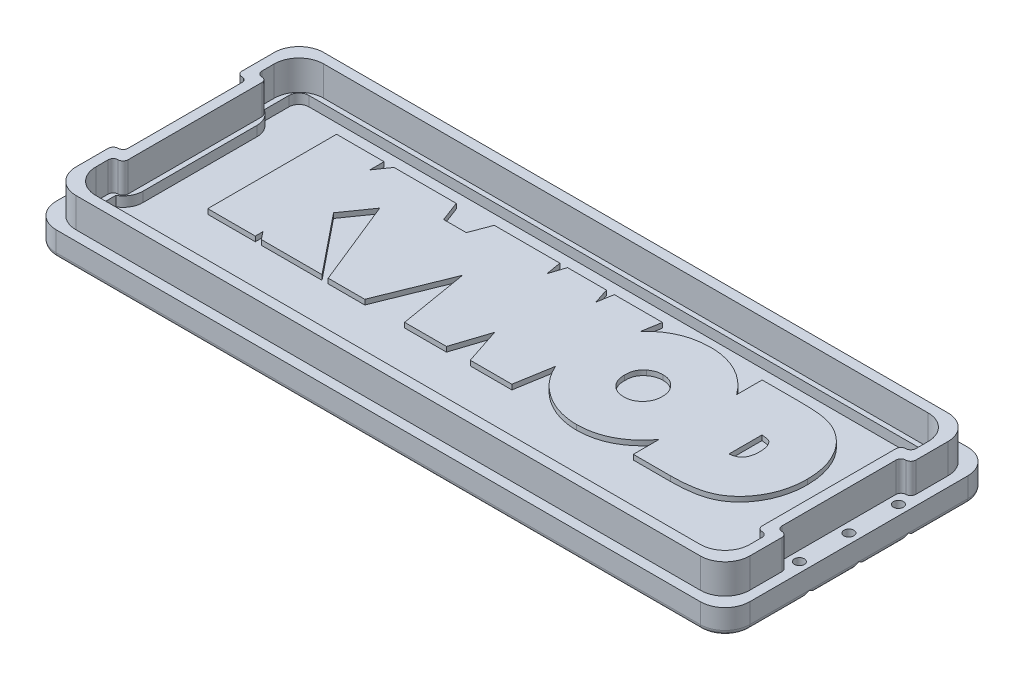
SolidWorks part; units mm, degrees
ref_plane "Front Plane" through (0, 0, 0) normal (0, 0, 1) x (1, 0, 0)
ref_plane "Top Plane" through (0, 0, 0) normal (0, 1, 0) x (1, 0, 0)
ref_plane "Right Plane" through (0, 0, 0) normal (1, 0, 0) x (0, 0, -1)
sketch "Sketch1" plane through (0, 0, 0) normal (0, 1, 0) x (1, 0, 0)
  line L1 (-70, 27) -> (70, 27)
  line L2 (-70, 27) -> (-70, -27)
  line L3 (-70, -27) -> (70, -27)
  line L4 (70, 27) -> (70, -27)
  line L5 (-70, 27) -> (70, -27) construction
  line L6 (-70, -27) -> (70, 27) construction
  point P0 (0, 0)
  dimension "D1" = 140
  dimension "D2" = 54
extrude "Boss-Extrude1" add sketch "Sketch1" along normal blind 5
sketch "Sketch3" plane through (0, 5, 0) normal (0, 1, 0) x (1, 0, 0)
  line L0 (66, -23) -> (66, 23)
  line L1 (66, 23) -> (-66, 23)
  line L2 (-66, 23) -> (-66, -23)
  line L3 (-66, -23) -> (66, -23)
  line L4 (-70, 0) -> (-66, 0)
  line L5 (-70, 27) -> (-70, -27) construction
  line L6 (0, 27) -> (0, 25)
  line L7 (-70, 12.5) -> (-66, 12.5)
  line L8 (68, -25) -> (68, 25)
  line L9 (68, 25) -> (-68, 25)
  line L10 (-68, 25) -> (-68, -25)
  line L11 (-68, -25) -> (68, -25)
  line L12 (68, -25) -> (68, 25)
  line L13 (68, 25) -> (-68, 25)
  line L14 (-68, 25) -> (-68, -25)
  line L15 (-68, -25) -> (68, -25)
  line L16 (-70, 12.5) -> (-70, -12.5)
  line L17 (-70, -12.5) -> (-66, -12.5)
  line L18 (-66, 12.5) -> (-66, -12.5)
  line L19 (-70, 12.5) -> (-66, -12.5) construction
  line L20 (-70, -12.5) -> (-66, 12.5) construction
  line L21 (70, 27) -> (-70, 27) construction
  line L22 (70, -12.5) -> (66, -12.5)
  line L23 (66, 12.5) -> (66, -12.5)
  line L24 (70, 12.5) -> (66, 12.5)
  line L25 (70, 12.5) -> (70, -12.5)
  line L26 (-68, -14.5) -> (-64, -14.5)
  line L27 (68, 14.5) -> (64, 14.5)
  line L29 (68, -14.5) -> (64, -14.5)
  line L30 (64, 14.5) -> (64, -14.5)
  line L31 (70, 7.25) -> (64, -14.5) construction
  line L32 (70, -7.25) -> (64, 14.5) construction
  line L33 (-68, 14.5) -> (-64, 14.5)
  line L34 (-64, 14.5) -> (-64, -14.5)
  point P12 (-68, 0)
  point P25 (68, 0)
  dimension "D3" = 25
  dimension "D5" = 29
  dimension "D1" = 2
  dimension "D2" = 2
extrude "Boss-Extrude2" add sketch "Sketch3" along normal blind 6 contours L14 L33 L2 L1 L0 L27 L12 L13 | L34 L33 L2 L26 | L33 L14 L7 L2 | L14 L26 L2 L17 | L12 L29 L0 L3 L2 L26 L14 L15 | L29 L12 L22 L0 | L27 L30 L29 L0 | L12 L27 L0 L24
fillet "Fillet2" radius 1 16 edges at (-64, 8, 14.5) (-66, 8, 14.5) (-66, 8, -14.5) (-64, 8, -14.5) (66, 8, -14.5) (64, 8, -14.5) (64, 8, 14.5) (66, 8, 14.5) (68, 8, 12.5) (66, 8, 12.5) (68, 8, -12.5) (66, 8, -12.5) (-68, 8, 12.5) (-68, 8, -12.5) (-66, 8, 12.5) (-66, 8, -12.5)
fillet "Fillet3" radius 5 12 edges at (66, 8, -23) (68, 8, -25) (70, 2.5, -27) (66, 8, 23) (70, 2.5, 27) (68, 8, 25) (-66, 8, 23) (-68, 8, 25) (-70, 2.5, 27) (-66, 8, -23) (-70, 2.5, -27) (-68, 8, -25)
sketch "Sketch4" plane through (0, 0, 0) normal (0, -1, 0) x (-1, 0, 0)
  line L0 (70, 0) -> (66, 0)
  line L1 (70, 22) -> (70, -22) construction
  line L3 (70, -12.5) -> (66, -12.5)
  line L4 (70, -12.5) -> (70, 12.5)
  line L5 (70, 12.5) -> (66, 12.5)
  line L6 (66, -12.5) -> (66, 12.5)
  line L7 (70, -12.5) -> (66, 12.5) construction
  line L8 (70, 12.5) -> (66, -12.5) construction
  circle A0 centre (68, 0) radius 1
  circle A1 centre (68, -10) radius 1
  circle A2 centre (68, 0) radius 1
  circle A3 centre (68, 10) radius 1
  point P5 (68, 0)
  dimension "D3" = 2
  dimension "D1" = 4
  dimension "D2" = 25
  dimension "D4" = 2
extrude "Cut-Extrude1" cut sketch "Sketch4" against normal blind 6 contours L0 A0 | L0 A0 | A1 | A3
mirror "Mirror1" about plane through (0, 0, 0) normal (1, 0, 0) of "Cut-Extrude1"
fillet "Fillet4" radius 1 8 edges at (68.5355, 0, -25.5355) (70, 0, 0) (68.5355, 0, 25.5355) (0, 0, 27) (-68.5355, 0, 25.5355) (-70, 0, 0) (-68.5355, 0, -25.5355) (0, 0, -27)
sketch "Sketch5" plane through (0, 0, 0) normal (0, -1, 0) x (-1, 0, 0)
  line L0 (69, 16) -> (-69, 16) construction
  line L1 (69, 10) -> (69, 22) construction
  line L2 (-69, 22) -> (-69, 10) construction
  text T0 "<b>KAMOD</b>" font "Century Gothic" height 20
extrude "Cut-Extrude2" cut sketch "Sketch5" against normal blind 1
shell "Shell1" thickness 3
sketch "Sketch6" plane through (0, 0, 0) normal (0, -1, 0) x (-1, 0, 0)
  line L0 (0, -26) -> (0, -22.1891)
  line L1 (-65, -26) -> (65, -26) construction
  circle A0 centre (68, 10) radius 2
  circle A1 centre (68, 0) radius 2
  circle A2 centre (68, -10) radius 2
  circle A3 centre (-68, 10) radius 2
  circle A4 centre (-68, 0) radius 2
  circle A5 centre (-68, -10) radius 2
  dimension "D1" = 3
extrude "Cut-Extrude5" cut sketch "Sketch6" against normal blind 1 contours A2 | A1 | A0 | A5 | A4 | A3
